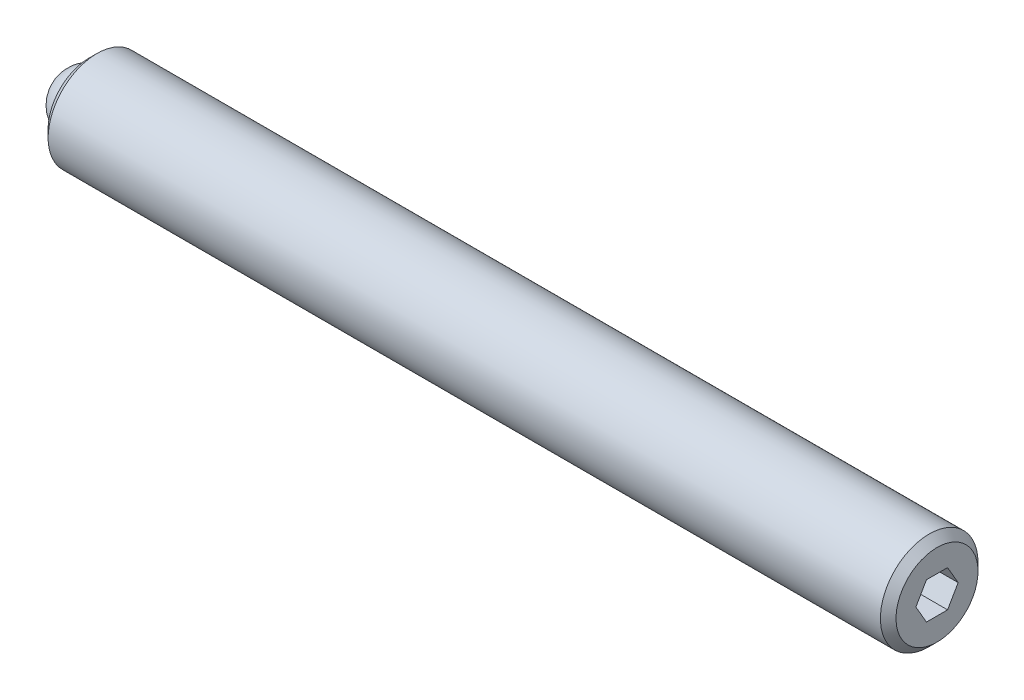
SolidWorks part; units mm, degrees
ref_plane "Front Plane" through (0, 0, 0) normal (0, 0, 1) x (1, 0, 0)
ref_plane "Top Plane" through (0, 0, 0) normal (0, 1, 0) x (1, 0, 0)
ref_plane "Right Plane" through (0, 0, 0) normal (1, 0, 0) x (0, 0, -1)
sketch "Sketch2" plane through (0, 0, 0) normal (1, 0, 0) x (0, 0, -1)
  circle A0 centre (0, 0) radius 3.175
  dimension "D1" = 6.35
extrude "Boss-Extrude1" add sketch "Sketch2" along normal blind 55.1656
sketch "Sketch3" plane through (0, 0, 0) normal (-1, 0, 0) x (0, 0, 1)
  circle A0 centre (0, 0) radius 1.9812
  dimension "D1" = 3.9624
chamfer "Chamfer1" distance 0.508 angle 45 1 edges at (0, 0, -3.175)
chamfer "Chamfer2" distance 0.508 angle 45 1 edges at (55.1656, 0, -3.175)
sketch "Sketch4" plane through (55.1656, 0, 0) normal (1, 0, 0) x (0, 0, -1)
  line L1 (1.3748, 0) -> (0.6874, 1.1906)
  line L2 (0.6874, 1.1906) -> (-0.6874, 1.1906)
  line L3 (-0.6874, 1.1906) -> (-1.3748, 0)
  line L4 (-1.3748, 0) -> (-0.6874, -1.1906)
  line L5 (-0.6874, -1.1906) -> (0.6874, -1.1906)
  line L6 (0.6874, -1.1906) -> (1.3748, 0)
  circle A0 centre (0, 0) radius 1.1906 construction
  dimension "D1" = 2.3813
extrude "Cut-Extrude2" cut sketch "Sketch4" against normal blind 2.286
extrude "Cut-Extrude3" cut sketch "Sketch3" against normal blind 1.9844
sketch "Sketch5" plane through (0, 0, 0) normal (-1, 0, 0) x (0, 0, 1)
  line L0 (0, 0) -> (0, -1.9844)
  line L1 (0, 0) -> (0, 1.9844)
  arc A0 (0, 1.9844) -> (0, -1.9844) centre (0, 0) ccw
  dimension "D1" = 1.9844
revolve "Revolve1" add sketch "Sketch5" angle 360 about L1
